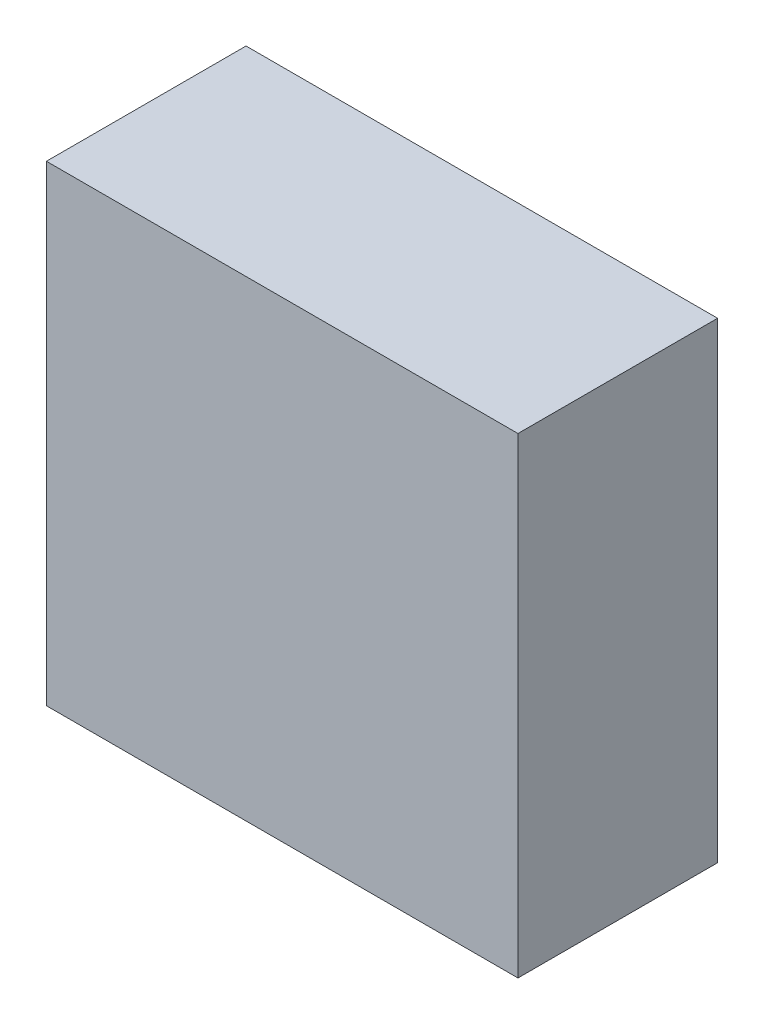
SolidWorks part; units mm, degrees
ref_plane "Front Plane" through (0, 0, 0) normal (0, 0, 1) x (1, 0, 0)
ref_plane "Top Plane" through (0, 0, 0) normal (0, 1, 0) x (1, 0, 0)
ref_plane "Right Plane" through (0, 0, 0) normal (1, 0, 0) x (0, 0, -1)
sketch "Sketch1" plane through (0, 0, 0) normal (0, 0, 1) x (1, 0, 0)
  line L1 (0, 0) -> (120, 0)
  line L2 (0, 0) -> (0, 120)
  line L3 (0, 120) -> (120, 120)
  line L4 (120, 0) -> (120, 120)
  dimension "D1" = 120
  dimension "D2" = 120
extrude "Boss-Extrude1" add sketch "Sketch1" along normal blind 50.8
